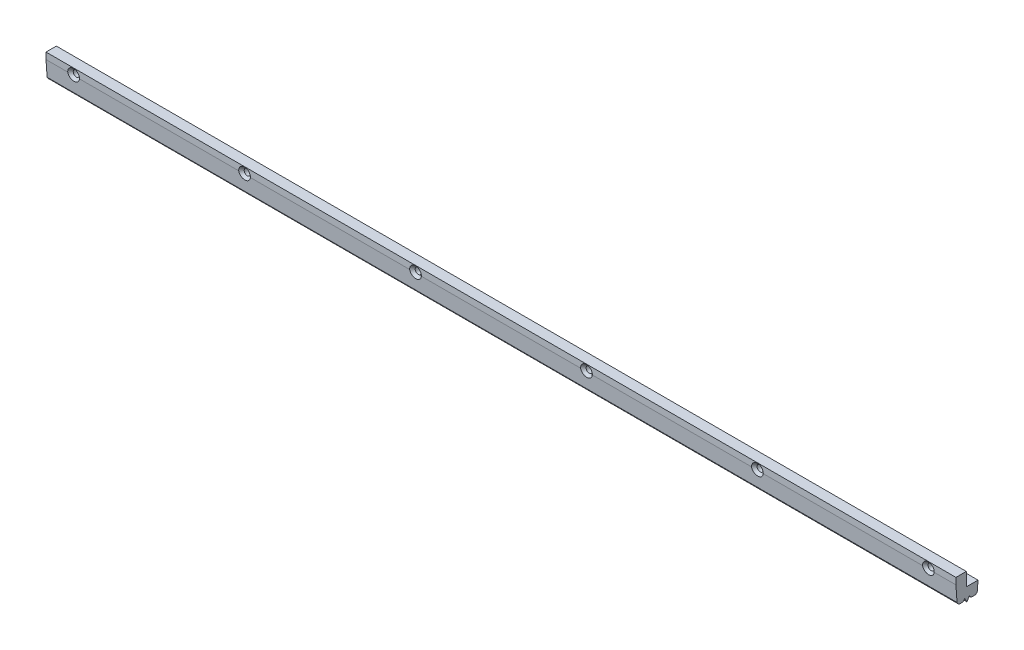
SolidWorks part; units mm, degrees
ref_plane "Plan de face" through (0, 0, 0) normal (0, 0, 1) x (1, 0, 0)
ref_plane "Plan de dessus" through (0, 0, 0) normal (0, 1, 0) x (1, 0, 0)
ref_plane "Plan de droite" through (0, 0, 0) normal (1, 0, 0) x (0, 0, -1)
sketch "Esquisse1" plane through (0, 0, 0) normal (1, 0, 0) x (0, 0, -1)
  line L1 (8, 9.7) -> (7.5497, 3.2605)
  line L2 (-8, 14.7) -> (-7.2001, 3.2605)
  line L3 (0, 0) -> (1.75, 3.0311)
  line L4 (0, 0) -> (-1.75, 3.0311)
  line L5 (-1.75, 3.0311) -> (-2.403, 1.9)
  line L6 (-3.2691, 1.4) -> (-4.7049, 1.4)
  line L7 (1.75, 3.0311) -> (2.403, 1.9)
  line L8 (3.2691, 1.4) -> (5.5546, 1.4)
  line L9 (-0.5, 19.4) -> (-0.5, 9.7)
  line L11 (-8, 19.4) -> (-8, 14.7)
  line L12 (8, 9.7) -> (-0.5, 9.7)
  line L16 (-0.5, 19.4) -> (-8, 19.4)
  arc A0 (-7.2001, 3.2605) -> (-4.7049, 1.4) centre (-4.7659, 3.9216) ccw
  arc A1 (-3.2691, 1.4) -> (-2.403, 1.9) centre (-3.2691, 2.4) ccw
  arc A2 (5.5546, 1.4) -> (7.5497, 3.2605) centre (5.5546, 3.4) ccw
  arc A3 (2.403, 1.9) -> (3.2691, 1.4) centre (3.2691, 2.4) ccw
extrude "Extrusion1" add sketch "Esquisse1" along normal mid plane 660
hole_wizard "Fraisage pour vis à tête fraisée M41" positions "Esquisse3" profile "Esquisse2" countersink size "M4" standard "ISO"
sketch "Esquisse3" plane through (0, 0, 8) normal (0, 0, 1) x (1, 0, 0)
  line L0 (-330, 19.4) -> (-330, 14.7) construction
  line L1 (330, 19.4) -> (330, 14.7) construction
  line L2 (330, 19.4) -> (-330, 19.4) construction
  point P0 (-310, 14.9)
  point P1 (-186, 14.9)
  point P2 (-62, 14.9)
  point P3 (62, 14.9)
  point P4 (186, 14.9)
  point P5 (310, 14.9)
  dimension "D1" = 20
  dimension "D2" = 124
  dimension "D3" = 124
  dimension "D4" = 124
  dimension "D5" = 124
  dimension "D6" = 124
  dimension "D7" = 4.5
sketch "Esquisse2" plane through (-310, 14.9, 8) normal (1, 0, 0) x (0, -1, 0)
  line L0 (0, 0) -> (0, 16)
  line L1 (0, 16) -> (2.25, 16)
  line L2 (2.25, 16) -> (2.25, 2)
  line L3 (2.25, 2) -> (4.25, 0)
  line L5 (4.25, 0) -> (0, 0)
  line L6 (-2.25, 2) -> (-4.25, 0) construction
  line L11 (0, -6.35) -> (0, 107.95) construction
  dimension "Diamètre du perçage jusqu'au prochain" = 4.5
  dimension "Profondeur du perçage jusqu'au prochain" = 16
  dimension "Diamètre du fraisage entrant" = 8.5
  dimension "Angle du fraisage entrant" = 90
